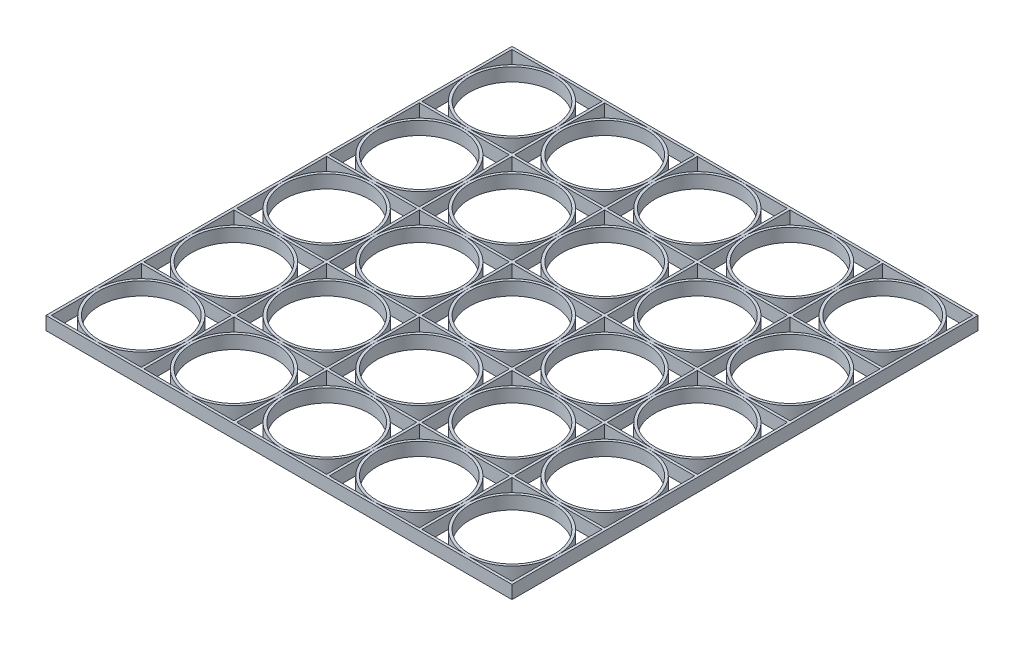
SolidWorks part; units mm, degrees
ref_plane "Front Plane" through (0, 0, 0) normal (0, 0, 1) x (1, 0, 0)
ref_plane "Top Plane" through (0, 0, 0) normal (0, 1, 0) x (1, 0, 0)
ref_plane "Right Plane" through (0, 0, 0) normal (1, 0, 0) x (0, 0, -1)
sketch "Sketch1" plane through (0, 0, 0) normal (0, 1, 0) x (1, 0, 0)
  line L1 (-17.55, 17.55) -> (17.55, 17.55)
  line L2 (-17.55, 17.55) -> (-17.55, -17.55)
  line L3 (-17.55, -17.55) -> (17.55, -17.55)
  line L4 (17.55, 17.55) -> (17.55, -17.55)
  line L5 (-17.55, 17.55) -> (17.55, -17.55) construction
  line L6 (-17.55, -17.55) -> (17.55, 17.55) construction
  line L7 (-17.05, 17.05) -> (17.05, 17.05)
  line L8 (-17.05, 17.05) -> (-17.05, -17.05)
  line L9 (-17.05, -17.05) -> (17.05, -17.05)
  line L10 (17.05, 17.05) -> (17.05, -17.05)
  line L11 (-17.05, 17.05) -> (17.05, -17.05) construction
  line L12 (-17.05, -17.05) -> (17.05, 17.05) construction
  point P0 (0, 0)
  point P6 (0, 0)
  dimension "D1" = 35.1
  dimension "D2" = 0.5
extrude "Boss-Extrude1" add sketch "Sketch1" along normal blind 5
sketch "Sketch2" plane through (0, 0, 0) normal (0, 1, 0) x (1, 0, 0)
  line L0 (-17.05, 17.05) -> (-17.05, -17.05) construction
  circle A0 centre (0, 0) radius 17.05
  circle A1 centre (0, 0) radius 16.05
  dimension "D1" = 1
extrude "Boss-Extrude2" add sketch "Sketch2" along normal blind 5 separate body
pattern_linear "LPattern2" count 5 spacing 35.1 along (1, 0, 0)
pattern_linear "LPattern3" count 5 spacing 35.1 along (0, 0, 1)
sketch "Sketch3" plane through (0, 0, 0) normal (0, 1, 0) x (1, 0, 0)
  line L0 (157.95, -157.95) -> (157.95, -122.85) construction
  line L1 (-17.55, 17.55) -> (157.95, 17.55)
  line L2 (-17.55, 17.55) -> (-17.55, -157.95)
  line L3 (-17.55, -157.95) -> (157.95, -157.95)
  line L4 (157.95, 17.55) -> (157.95, -157.95)
extrude "Extrude-Thin1" add sketch "Sketch3" along normal blind 5 thin
